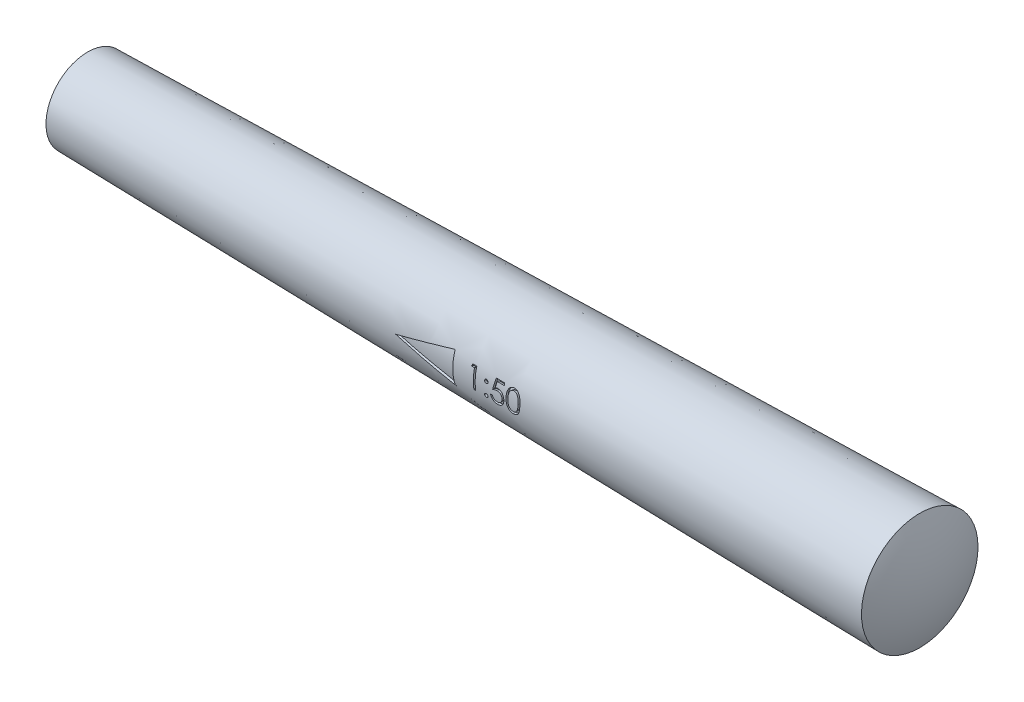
SolidWorks part; units mm, degrees
ref_plane "Front Plane" through (0, 0, 0) normal (0, 0, 1) x (1, 0, 0)
ref_plane "Top Plane" through (0, 0, 0) normal (0, 1, 0) x (1, 0, 0)
ref_plane "Right Plane" through (0, 0, 0) normal (1, 0, 0) x (0, 0, -1)
sketch "Sketch1" plane through (0, 0, 0) normal (1, 0, 0) x (0, 0, -1)
  circle A0 centre (0, 0) radius 2
  dimension "D1" = 4
extrude "Extrude1" add sketch "Sketch1" along normal mid plane 40
draft "Draft1" type of draft neutral plane draft angle 1.146 faces to draft 1 parameters "D1"=1.146
sketch "Sketch2" plane through (0, 0, 0) normal (0, 0, 1) x (1, 0, 0)
  line L0 (-20, 0) -> (-20, 2)
  line L1 (-20, 2) -> (-20, -2) construction
  line L2 (-20, 0) -> (-20.6, 0)
  line L3 (-20.6, 0) -> (-20.6, -2.4) construction
  line L4 (20, 0) -> (20, 2.8)
  line L5 (20, -2.8) -> (20, 2.8) construction
  line L6 (20, 0) -> (20.6, 0)
  line L7 (20.6, 0) -> (20.6, -2.4) construction
  line L8 (-20, -2) -> (20, -2.8) construction
  arc A0 (-20.6, 0) -> (-20, 2) centre (-16.9667, 0) cw
  arc A1 (20.6, 0) -> (20, 2.8) centre (13.7665, 0) ccw
  point P14 (0, -2.4)
revolve "Revolve1" add sketch "Sketch2" angle 360 about L2
sketch "Sketch5" plane through (0, 0, 0) normal (0, 0, 1) x (1, 0, 0)
  line L0 (0, 2.4) -> (0, -2.4) construction
  line L1 (20, 2.8) -> (-20, 2) construction
  line L2 (-20, -2) -> (20, -2.8) construction
ref_plane "Plane2" through (0, 0, 0) normal (-0.02, 0, 0.9998) x (0.9998, 0, 0.02)
sketch "Sketch6" plane through (0, 0, 0) normal (-0.02, 0, 0.9998) x (0.9998, 0, 0.02)
  line L0 (0, 0) -> (0, 0.75)
  line L1 (0, 2.4) -> (0, -2.4) construction
  line L2 (0, 0.75) -> (-2.799, 0)
  line L3 (-2.799, 0) -> (0, -0.75)
  line L4 (0, -0.75) -> (0, 0)
  line L5 (0, -0.375) -> (4, -0.375) construction
  text T0 "1:50" font "Century Gothic" height 1
  dimension "D1" = 1.5
  dimension "D2" = 30
  dimension "D3" = 4
wrap "Wrap2" sketch "Sketch6" wrap type deboss source sketch "Sketch6" thickness 0.1 parameters "D1"=0.1
equation "\"D2@Sketch2\" = \"D1@Sketch2\""
